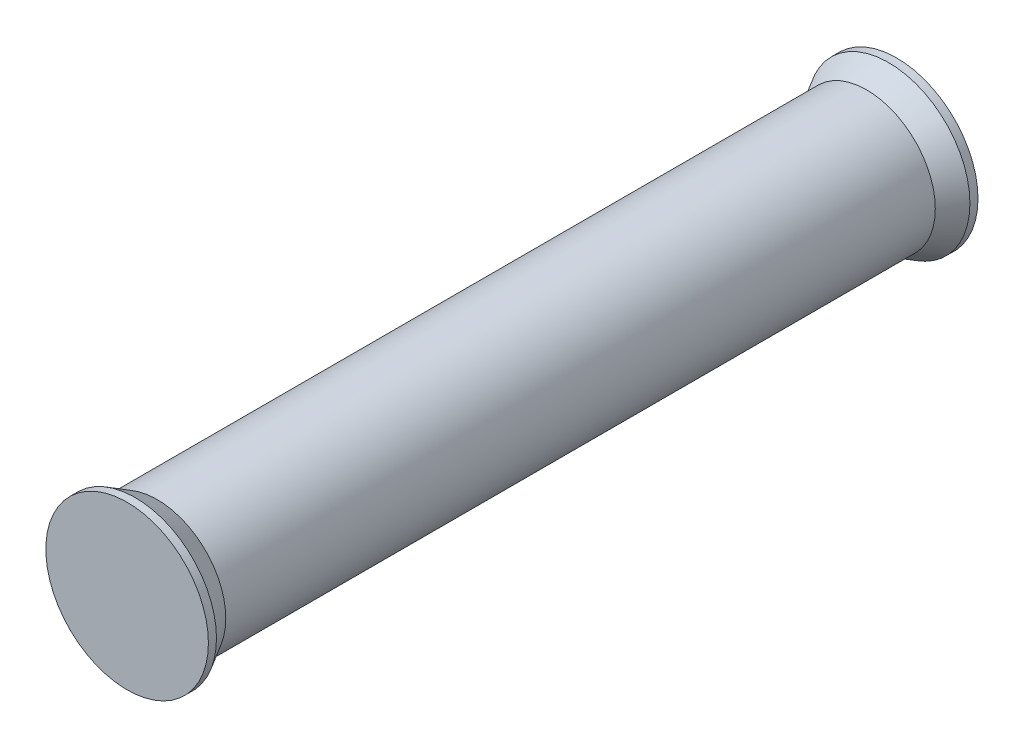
SolidWorks part; units mm, degrees
ref_plane "Спереди" through (0, 0, 0) normal (0, 0, 1) x (1, 0, 0)
ref_plane "Сверху" through (0, 0, 0) normal (0, 1, 0) x (1, 0, 0)
ref_plane "Справа" through (0, 0, 0) normal (1, 0, 0) x (0, 0, -1)
sketch "Эскиз1" plane through (0, 0, 0) normal (1, 0, 0) x (0, 0, -1)
  line L0 (0, 0) -> (76.2052, 0) construction
  line L1 (0, 0) -> (48.8188, 0)
  line L2 (48.8188, 0) -> (48.8188, 5.1562)
  line L3 (48.8188, 5.1562) -> (48.3062, 5.1562)
  line L4 (48.3062, 5.1562) -> (46.9138, 4.3523)
  line L5 (46.9138, 4.3523) -> (1.905, 4.3523)
  line L6 (1.905, 4.3523) -> (0.5126, 5.1562)
  line L7 (0.5126, 5.1562) -> (0, 5.1562)
  line L8 (0, 5.1562) -> (0, 0)
  dimension "D1" = 48.8188
  dimension "D2" = 30
  dimension "D3" = 30
  dimension "D4" = 8.7046
  dimension "D5" = 10.3124
  dimension "D6" = 1.905
  dimension "D7" = 1.905
revolve "Повернуть1" add sketch "Эскиз1" angle 360 about L0
